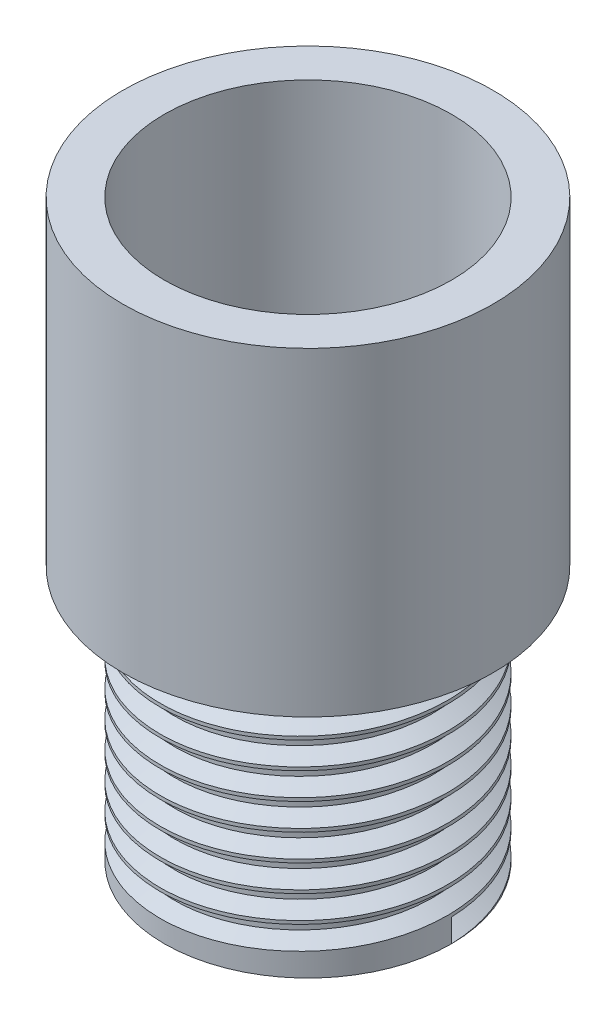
SolidWorks part; units mm, degrees
ref_plane "Front Plane" through (0, 0, 0) normal (0, 0, 1) x (1, 0, 0)
ref_plane "Top Plane" through (0, 0, 0) normal (0, 1, 0) x (1, 0, 0)
ref_plane "Right Plane" through (0, 0, 0) normal (1, 0, 0) x (0, 0, -1)
sketch "Sketch1" plane through (0, 0, 0) normal (0, 1, 0) x (1, 0, 0)
  circle A0 centre (0, 0) radius 7.366
  dimension "D1" = 14.732
extrude "Boss-Extrude1" add sketch "Sketch1" along normal blind 12.7
sketch "Sketch2" plane through (0, 0, 0) normal (0, -1, 0) x (1, 0, 0)
  circle A0 centre (0, 0) radius 5.715
  dimension "D1" = 11.43
extrude "Boss-Extrude2" add sketch "Sketch2" along normal blind 10.16
thread "Thread1" pitch 1.0583 start angle 0, offset 0, length 10.16, pitch 1.0583, diameter 11.43
ref_plane "Plane1" through (5.715, -10.16, 0) normal (0, 0, 1) x (1, 0, 0)
sketch "Thread Profile1" plane through (5.715, -10.16, 0) normal (0, 0, 1) x (1, 0, 0)
  line L0 (0, 0) -> (0, 1.0583) construction
  line L11 (0, 0) -> (0, 0.926)
  line L12 (0, 0.926) -> (-0.5728, 0.5953)
  line L13 (-0.5728, 0.5953) -> (-0.5728, 0.3307)
  line L15 (-0.5728, 0.3307) -> (0, 0)
  line L17 (-0.5728, 0.463) -> (0, 0.463) construction
  point P2 (0, 0)
  dimension "Pitch" = 1.0583
  dimension "Profile_Angle" = 60
  dimension "Profile_Land" = 0.2646
  dimension "Profile_Height" = 0.5728
sketch "Sketch5" plane through (0, 12.7, 0) normal (0, 1, 0) x (1, 0, 0)
  circle A0 centre (0, 0) radius 5.715
  dimension "D1" = 11.43
extrude "Cut-Extrude1" cut sketch "Sketch5" against normal blind 10.16
